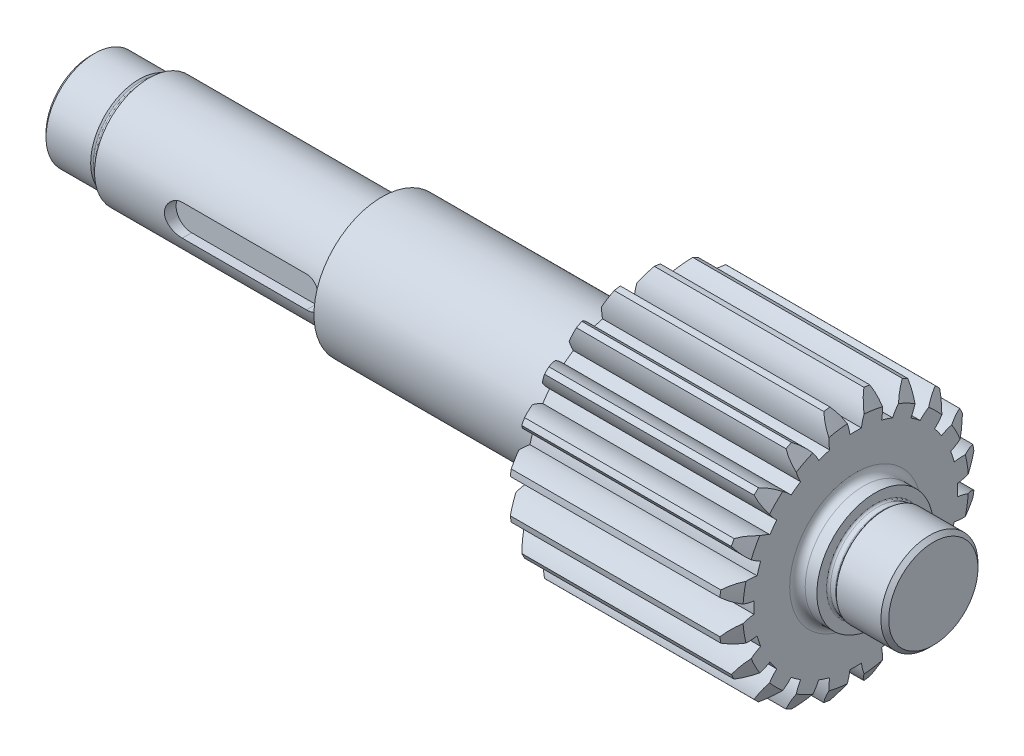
SolidWorks part; units mm, degrees
ref_plane "Plane1" through (0, 0, 0) normal (0, 0, 1) x (1, 0, 0)
ref_plane "Plane2" through (0, 0, 0) normal (0, 1, 0) x (1, 0, 0)
ref_plane "Plane3" through (0, 0, 0) normal (1, 0, 0) x (0, 0, -1)
sketch "HoldingSke" plane through (0, 0, 0) normal (0, 1, 0) x (1, 0, 0)
  line L0 (0, 0) -> (0.3132, -0.114)
  line L1 (-15, 0) -> (100, 0) construction
  line L2 (0, 0) -> (-2.1039, 2.3779)
  line L3 (0, 0) -> (-11.863, 4.5341)
  line L4 (0, 0) -> (8.1152, 2.9537)
  line L5 (0, 0) -> (-46.8476, -17.4728)
  line L6 (0, 0) -> (-41.4481, -27.9652)
  line L7 (-2.1039, 2.3779) -> (8.661, 51.2168)
  line L8 (-76.2, 54.61) -> (-76.1, 54.61)
  line L9 (-71.009, 38.7566) -> (-53.1078, 45.2721)
  line L10 (-76.2, 71.12) -> (104.1128, 71.12)
  line L11 (0, 0) -> (-50, 0)
  line L12 (-76.2, 101.6) -> (-76.093, 101.6)
  line L13 (24.9733, 27.94) -> (52.9518, 28.4284)
  line L14 (24.9733, 27.94) -> (24.9743, 27.94)
  line L15 (24.9733, 27.94) -> (100.4006, 29.5858)
  line L16 (-63.627, -3) -> (-12.827, -3)
  circle A0 centre (0, 0) radius 0.1
  circle A1 centre (0, 0) radius 26.249
  circle A2 centre (0, 0) radius 37.5
  circle A3 centre (0, 0) radius 0.1
sketch "BasProSke" plane through (0, 0, 0) normal (0, 1, 0) x (1, 0, 0)
  line L0 (-10, 0) -> (60, 0) construction
  line L1 (0, 0) -> (0, 33)
  line L2 (0, 0) -> (58.5, 0)
  line L3 (58.5, 0) -> (58.5, 33)
  line L4 (58.5, 33) -> (0, 33)
revolve "Base-Revolve" add sketch "BasProSke" angle 360 about L0
sketch "TooCutSke" plane through (0, 0, 0) normal (1, 0, 0) x (0, 0, -1)
  line L1 (0, 0) -> (0, 107) construction
  line L2 (0, 0) -> (-2.5409, 29.8922) construction
  line L3 (0, 0) -> (-9.3616, 59.1066) construction
  line L4 (-2.5409, 29.8922) -> (-4.6808, 29.5533) construction
  arc A0 (1.4893, 26.2067) -> (-1.4893, 26.2067) centre (0, 0) ccw
  arc A1 (4.4016, 32.7308) -> (-4.4016, 32.7308) centre (0, 0) ccw
  circle A2 centre (0, 0) radius 30 construction
  circle A3 centre (0, 0) radius 28.1908 construction
  arc A4 (-1.4893, 26.2067) -> (-4.4016, 32.7308) centre (-13.4064, 24.799) ccw
  arc A5 (4.4016, 32.7308) -> (1.4893, 26.2067) centre (13.4064, 24.799) ccw
extrude "ToothCut" cut sketch "TooCutSke" along normal through all
fillet "Breaks" [suppressed] radius 0.06
fillet "RootFillets" [suppressed] radius 0.751
pattern_circular "TeethCuts" count 20 every 18 about axis through (-10, 0, 0) along (1, 0, 0) of "ToothCut", "RootFillets", "Breaks"
sketch "HubNeaOneSke" plane through (0, 0, 0) normal (-1, 0, 0) x (0, 0, 1)
  circle A0 centre (0, 0) radius 26.249
extrude "HubNearOne" [suppressed] add sketch "HubNeaOneSke" along normal blind 0.0073
sketch "HubNeaBotSke" plane through (0, 0, 0) normal (-1, 0, 0) x (0, 0, 1)
  circle A0 centre (0, 0) radius 26.249
extrude "HubNearBoth" [suppressed] add sketch "HubNeaBotSke" along normal blind 0.0037
ref_plane "FarPln" through (50, 0, 0) normal (1, 0, 0) x (0, 0, -1)
sketch "HubFarSke" plane through (50, 0, 0) normal (1, 0, 0) x (0, 0, -1)
  circle A0 centre (0, 0) radius 26.249
extrude "HubFar" [suppressed] add sketch "HubFarSke" along normal blind 0.0037
sketch "BorSke" plane through (0, 0, 0) normal (1, 0, 0) x (0, 0, -1)
  circle A0 centre (0, 0) radius 0.1
sketch "KeySke" plane through (0, 0, 0) normal (1, 0, 0) x (0, 0, -1)
  line L0 (-0.05, 0) -> (-0.05, 0.2)
  line L1 (-0.05, 0.2) -> (0.05, 0.2)
  line L2 (0.05, 0.2) -> (0.05, 0)
  line L3 (0, 0) -> (0, 34) construction
  line L4 (-0.05, 0) -> (0.05, 0)
extrude "Keyway" [suppressed] cut sketch "KeySke" along normal mid plane 100.0225
pattern_circular "Keyway2" [suppressed] count 2 every 90 about axis through (-10, 0, 0) along (1, 0, 0)
sketch "Sketch1" plane through (0, 0, 0) normal (0, 0, 1) x (1, 0, 0)
  line L0 (199.554, 0) -> (-221.3943, 0) construction
  line L1 (58.5, 0) -> (58.5, 15)
  line L2 (58.5, -1.4893) -> (58.5, 1.4893) construction
  line L3 (58.5, 15) -> (63.5, 15)
  line L4 (63.5, 15) -> (63.5, 12.5)
  line L5 (63.5, 12.5) -> (78.5, 12.5)
  line L6 (78.5, 12.5) -> (78.5, 0)
  line L7 (78.5, 0) -> (58.5, 0)
  line L8 (0, 0) -> (0, 17.5)
  line L11 (0, 17.5) -> (-63.5, 17.5)
  line L12 (-63.5, 17.5) -> (-63.5, 14)
  line L13 (-63.5, 14) -> (-123.5, 14)
  line L14 (-123.5, 14) -> (-123.5, 12.5)
  line L15 (-123.5, 12.5) -> (-138.5, 12.5)
  line L16 (-138.5, 12.5) -> (-138.5, 0)
  line L17 (-138.5, 0) -> (0, 0)
  dimension "D1" = 25
  dimension "D2" = 30
  dimension "D3" = 15
  dimension "D4" = 20
  dimension "D5" = 25
  dimension "D6" = 28
  dimension "D7" = 35
  dimension "D8" = 15
  dimension "D9" = 60
  dimension "D12" = 217
revolve "Revolve1" add sketch "Sketch1" angle 360 about L0
chamfer "Chamfer1" distance 1 angle 45 2 edges at (78.5, 0, -12.5) (-138.5, 0, -12.5)
sketch "Sketch2" plane through (0, 0, 0) normal (0, 0, 1) x (1, 0, 0)
  line L0 (59, 33.2078) -> (59, 28.2078)
  line L1 (59, 28.2078) -> (56.1132, 33.2078)
  line L2 (56.1132, 33.2078) -> (59, 33.2078)
  line L3 (58.5, 25.3843) -> (58.5, 32.461) construction
  line L4 (0, 32.7078) -> (58.5, 32.7078) construction
  line L5 (29.25, -32.7078) -> (29.25, 87.7883) construction
  line L6 (58.5, -32.7078) -> (0, -32.7078) construction
  line L7 (2.3868, 33.2078) -> (-0.5, 33.2078)
  line L8 (-0.5, 28.2078) -> (2.3868, 33.2078)
  line L9 (-0.5, 33.2078) -> (-0.5, 28.2078)
  line L10 (101.7484, 0) -> (-209.2648, 0) construction
  dimension "D1" = 0.5
  dimension "D2" = 0.5
  dimension "D3" = 30
  dimension "D4" = 5
revolve "Cut-Revolve1" cut sketch "Sketch2" angle 360 about L10
ref_plane "Plane4" through (0, 0, 15) normal (0, 0, 1) x (1, 0, 0)
sketch "Sketch3" plane through (0, 0, 15) normal (0, 0, 1) x (1, 0, 0)
  line L0 (-189.8027, 0) -> (104.5269, 0) construction
  line L1 (-101.5, 4) -> (-69.5, 4)
  line L2 (-69.5, -4) -> (-101.5, -4)
  line L3 (-63.5, 14) -> (-63.5, -14) construction
  arc A0 (-101.5, 4) -> (-101.5, -4) centre (-101.5, 0) ccw
  arc A1 (-69.5, -4) -> (-69.5, 4) centre (-69.5, 0) ccw
  point P4 (-65.5, 0)
  point P6 (-105.5, 0)
  dimension "D1" = 4
  dimension "D2" = 6
  dimension "D3" = 40
extrude "Cut-Extrude2" cut sketch "Sketch3" against normal blind 4
sketch "Sketch4" plane through (0, 0, 0) normal (0, 0, 1) x (1, 0, 0)
  line L0 (104.2118, 0) -> (-178.8, 0) construction
  line L1 (63.5, 12.5) -> (63.5, 12)
  line L2 (63.5, -15) -> (63.5, 15) construction
  line L3 (77.5, 12.5) -> (63.5, 12.5) construction
  line L4 (63.5, -12.5) -> (63.5, 12.5) construction
  line L5 (63.5, 12) -> (65.5, 12)
  line L6 (65.5, 12) -> (66, 12.5)
  line L7 (66, 12.5) -> (63.5, 12.5)
  line L8 (-123.5, 12.5) -> (-123.5, 12)
  line L9 (-123.5, 14) -> (-123.5, -14) construction
  line L10 (-123.5, 12) -> (-125.5, 12)
  line L11 (-125.5, 12) -> (-126, 12.5)
  line L12 (-123.5, 12.5) -> (-137.5, 12.5) construction
  line L13 (-126, 12.5) -> (-123.5, 12.5)
  dimension "D1" = 0.5
  dimension "D2" = 45
  dimension "D3" = 2
  dimension "D4" = 0.5
  dimension "D5" = 2
revolve "Cut-Revolve2" cut sketch "Sketch4" angle 360 about L0
fillet "Fillet1" radius 0.5 4 edges at (63.5, 12, 0) (65.5, 12, 0) (-125.5, 12, 0) (-123.5, 12, 0)
fillet "Fillet2" radius 0.5 1 edges at (-63.5, 0, -14)
fillet "Fillet3" radius 2 2 edges at (58.5, 0, -15) (0, 0, -17.5)
equation "' \"Module@HoldingSke\" = 6.35"
equation "' \"Num_teeth@HoldingSke\" = 12"
equation "' \"Ap@HoldingSke\" =  20"
equation "' \"Ap@HoldingSke\" = 20"
equation "' \"Width@HoldingSke\" = 0.5 * 25.4"
equation "' \"Hub_dia@HoldingSke\"= 1 * 25.4"
equation "' \"Hub_dia@HoldingSke\" = 1 * 25.4"
equation "' \"Overall_len@HoldingSke\" = 1.0 * 25.4"
equation "' \"Bore@HoldingSke\" = 0.75 * 25.4"
equation "' \"T_dim@HoldingSke\" = 0.1 * 25.4"
equation "' \"Width@KeySke\" = 0.25 * 25.4"
equation "' \"Show_teeth@HoldingSke\" = 13"
equation "' \"Backlash@HoldingSke\" = 0.009 * 25.4"
equation "' \"Addendum_fac@HoldingSke\" = 1.0"
equation "' \"Dedendum_fac@HoldingSke\" = 1.25"
equation "' \"Dedendum_add@HoldingSke\" = 0.00005 * 25.4"
equation "' \"Clearance_fac@HoldingSke\" = 0.25"
equation "\"Pitch@HoldingSke\" = 1 / \"Module@HoldingSke\""
equation "\"Overcut_dia@TooCutSke\" = (\"Num_teeth@HoldingSke\" + 2 * \"Addendum_fac@HoldingSke\") / \"Pitch@HoldingSke\" + 0.002 * 25.4"
equation "\"Pitch_dia@TooCutSke\" = \"Num_teeth@HoldingSke\" / \"Pitch@HoldingSke\""
equation "\"Base_dia@TooCutSke\" = \"Num_teeth@HoldingSke\" / \"Pitch@HoldingSke\" * cos((\"Ap@HoldingSke\"  * 3.14159265 / 180))"
equation "\"Root_dia@TooCutSke\" = (\"Num_teeth@HoldingSke\" + 2) / \"Pitch@HoldingSke\" - 2 * (\"Addendum_fac@HoldingSke\" + \"Dedendum_fac@HoldingSke\") / \"Pitch@HoldingSke\" - \"Dedendum_add@HoldingSke\" * 2"
equation "\"Half_ang@TooCutSke\" = 180 / \"Num_teeth@HoldingSke\""
equation "\"Half_CT@TooCutSke\" = \"Num_teeth@HoldingSke\" / \"Pitch@HoldingSke\" * sin((3.14159265 / 2 / \"Num_teeth@HoldingSke\")) / 2 - 7 * \"Backlash@HoldingSke\" / 4"
equation "\"Flank_rad@TooCutSke\" = \"Num_teeth@HoldingSke\" / \"Pitch@HoldingSke\" / 5"
equation "\"Radius@RootFillets\" = \"Clearance_fac@HoldingSke\" / \"Pitch@HoldingSke\" + \"Dedendum_add@HoldingSke\""
equation "\"Break_rad@Breaks\" = 0.02 / \"Pitch@HoldingSke\""
equation "\"Thickness@HoldingSke\" = \"Width@HoldingSke\""
equation "\"OAL@HoldingSke\" = \"Thickness@HoldingSke\""
equation "\"MHD@HoldingSke\" = (\"Num_teeth@HoldingSke\" + 2) / \"Pitch@HoldingSke\" - 2 * (\"Addendum_fac@HoldingSke\" + \"Dedendum_fac@HoldingSke\")  / \"Pitch@HoldingSke\" - \"Dedendum_add@HoldingSke\" * 2"
equation "\"MBD@HoldingSke\" = (\"Num_teeth@HoldingSke\" + 2) / \"Pitch@HoldingSke\" - 2 * (\"Addendum_fac@HoldingSke\" + \"Dedendum_fac@HoldingSke\")  / \"Pitch@HoldingSke\" - \"Dedendum_add@HoldingSke\" * 2 - 0.002 * 25.4"
equation "\"MHD@HoldingSke\" = ((sgn( \"MHD@HoldingSke\" - \"Hub_dia@HoldingSke\" )-1)*( \"MHD@HoldingSke\" - \"Hub_dia@HoldingSke\" ))/-2+ \"Hub_dia@HoldingSke\""
equation "\"MBD@HoldingSke\" = ((sgn( \"MBD@HoldingSke\" - \"Bore@HoldingSke\" )-1)*( \"MBD@HoldingSke\" - \"Bore@HoldingSke\" ))/-2+ \"Bore@HoldingSke\""
equation "\"OAL@HoldingSke\" = ((sgn( \"OAL@HoldingSke\" - \"Overall_len@HoldingSke\" )+1)*( \"OAL@HoldingSke\" - \"Overall_len@HoldingSke\" ))/2 + \"Overall_len@HoldingSke\" + 0.000002 * 25.4"
equation "\"Num_teeth@TeethCuts\" = int( \"Show_teeth@HoldingSke\" ) + 1"
equation "\"Num_teeth@TeethCuts\" = ((sgn( \"Num_teeth@TeethCuts\" - \"Num_teeth@HoldingSke\" )-1)*( \"Num_teeth@TeethCuts\" - \"Num_teeth@HoldingSke\" ))/-2+ \"Num_teeth@HoldingSke\""
equation "\"Num_teeth@TeethCuts\" = ((sgn( \"Num_teeth@TeethCuts\" - 2.0)+1)*( \"Num_teeth@TeethCuts\" - 2.0))/2 +2.0"
equation "\"Angle@TeethCuts\" = 360.0 / \"Num_teeth@HoldingSke\""
equation "\"Diameter@BasProSke\" = (\"Num_teeth@HoldingSke\" + 2 * \"Addendum_fac@HoldingSke\") / \"Pitch@HoldingSke\""
equation "\"Thickness@BasProSke\"  = \"Thickness@HoldingSke\""
equation "' \"Fillet_rad@BasProSke\" =  \"Thickness@HoldingSke\" * 0.05"
equation "' \"Fillet_rad@BasProSke\" = \"Thickness@HoldingSke\" * 0.05"
equation "\"MHD@HoldingSke\" = ((sgn( \"MHD@HoldingSke\" - \"Root_dia@TooCutSke\" )-1)*( \"MHD@HoldingSke\" - \"Root_dia@TooCutSke\" ))/-2+ \"Root_dia@TooCutSke\""
equation "\"Diameter@HubNeaOneSke\" = \"MHD@HoldingSke\""
equation "\"Length@HubNearOne\" = \"OAL@HoldingSke\" - \"Thickness@BasProSke\""
equation "\"Diameter@HubNeaBotSke\" = \"MHD@HoldingSke\""
equation "\"Length@HubNearBoth\" = ( \"OAL@HoldingSke\" - \"Thickness@BasProSke\" ) / 2.0"
equation "\"Thickness@FarPln\" = \"Thickness@BasProSke\""
equation "\"Diameter@HubFarSke\" = \"MHD@HoldingSke\""
equation "\"Length@HubFar\" = ( \"OAL@HoldingSke\" - \"Thickness@BasProSke\" ) / 2.0"
equation "\"Diameter@BorSke\" = \"MBD@HoldingSke\""
equation "\"D1@Bore\" = \"OAL@HoldingSke\" * 2.0"
equation "\"D1@Keyway\" = \"OAL@HoldingSke\" * 2.0"
equation "\"Offset@KeySke\" = \"T_dim@HoldingSke\" + \"MBD@HoldingSke\" / 2.0"
